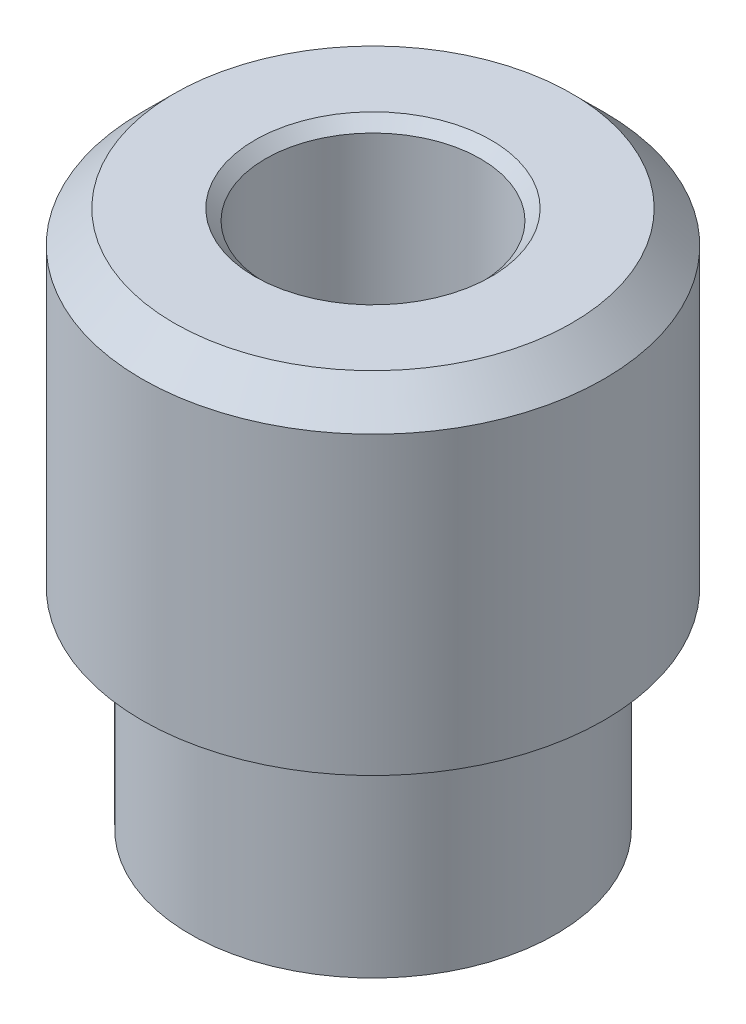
SolidWorks part; units mm, degrees
ref_plane "Přední rovina" through (0, 0, 0) normal (0, 0, 1) x (1, 0, 0)
ref_plane "Horní rovina" through (0, 0, 0) normal (0, 1, 0) x (1, 0, 0)
ref_plane "Pravá rovina" through (0, 0, 0) normal (1, 0, 0) x (0, 0, -1)
sketch "Skica1" plane through (0, 0, 0) normal (0, 1, 0) x (1, 0, 0)
  circle A0 centre (0, 0) radius 10.75
  dimension "D1" = 21.5
extrude "Přidat vysunutím1" add sketch "Skica1" along normal blind 25
sketch "Skica2" plane through (0, 0, 0) normal (0, -1, 0) x (1, 0, 0)
  circle A0 centre (0, 0) radius 8.5
  dimension "D1" = 17
extrude "Odebrat vysunutím1" cut sketch "Skica2" against normal blind 8.5 flip side to cut
chamfer "Zkosení1" distance 1.25 distance2 2.25 1 edges at (0, 8.5, -10.75)
fillet "Zaoblit1" radius 0.5 1 edges at (0, 8.5, -8.5)
sketch "Skica4" plane through (0, 0, 0) normal (0, -1, 0) x (1, 0, 0)
  circle A0 centre (0, 0) radius 5
extrude "Odebrat vysunutím2" cut sketch "Skica4" against normal through all
chamfer "Zkosení2" distance 0.5 angle 45 1 edges at (0, 25, -5)
chamfer "Zkosení3" distance 1.5 angle 45 1 edges at (0, 25, 10.75)
